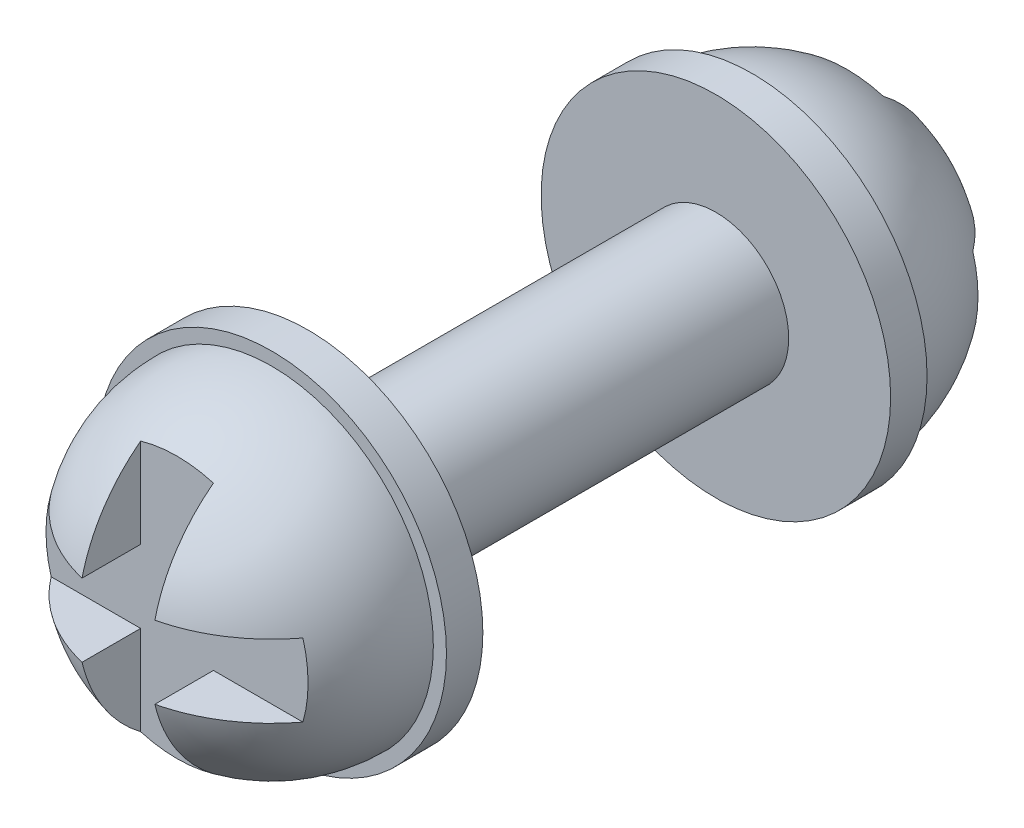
SolidWorks part; units mm, degrees
ref_plane "Front Plane" through (0, 0, 0) normal (0, 0, 1) x (1, 0, 0)
ref_plane "Top Plane" through (0, 0, 0) normal (0, 1, 0) x (1, 0, 0)
ref_plane "Right Plane" through (0, 0, 0) normal (1, 0, 0) x (0, 0, -1)
sketch "Sketch1" plane through (0, 0, 0) normal (1, 0, 0) x (0, 0, -1)
  line L0 (-8.89, 3.175) -> (-8.89, 7.62)
  line L1 (-8.89, 3.175) -> (8.89, 3.175)
  line L2 (-77.1786, 0) -> (81.0028, 0) construction
  line L3 (10.4775, 7.62) -> (8.89, 7.62)
  line L4 (-17.526, 0) -> (-17.526, -14.4217) construction
  line L5 (0, 0) -> (0, 20.5642) construction
  line L7 (8.89, 3.175) -> (8.89, 7.62)
  line L8 (-17.526, 0) -> (17.526, 0)
  line L9 (-10.4775, 7.0485) -> (-10.4775, 7.62)
  line L10 (-10.4775, 7.62) -> (-8.89, 7.62)
  line L11 (10.4775, 7.0485) -> (10.4775, 7.62)
  arc A0 (10.4775, 7.0485) -> (17.526, 0) centre (10.4775, 0) cw
  arc A2 (-10.4775, 7.0485) -> (-17.526, 0) centre (-10.4775, 0) ccw
  dimension "D2" = 17.78
  dimension "D4" = 35.052
  dimension "D1" = 6.35
  dimension "D3" = 15.24
  dimension "D5" = 1.5875
revolve "Revolve1" add sketch "Sketch1" angle 360 about L2
sketch "Sketch2" plane through (0, 0, 0) normal (1, 0, 0) x (0, 0, -1)
  line L0 (0, 0) -> (0, 18.0836) construction
  line L1 (-20.955, 1.5875) -> (-14.605, 1.5875)
  line L2 (-20.955, 1.5875) -> (-20.955, -1.5875)
  line L3 (-20.955, -1.5875) -> (-14.605, -1.5875)
  line L4 (-14.605, 1.5875) -> (-14.605, -1.5875)
  line L5 (0, 0) -> (-14.605, 0) construction
  line L7 (14.605, 1.5875) -> (14.605, -1.5875)
  line L8 (20.955, -1.5875) -> (14.605, -1.5875)
  line L9 (20.955, 1.5875) -> (20.955, -1.5875)
  line L10 (20.955, 1.5875) -> (14.605, 1.5875)
  line L11 (-8.89, -7.62) -> (-8.89, 7.62) construction
  dimension "D1" = 3.175
  dimension "D2" = 6.35
  dimension "D3" = 5.715
extrude "Cut-Extrude1" cut sketch "Sketch2" against normal through all both and the other way through all
sketch "Sketch3" plane through (0.0527, 0, -0.0149) normal (0, 1, 0) x (0, 0, -1)
  line L0 (-0.0149, 0.0527) -> (-0.0149, 18.6125) construction
  line L1 (-22.2399, 1.6402) -> (-14.6199, 1.6402)
  line L2 (-22.2399, 1.6402) -> (-22.2399, -1.5348)
  line L3 (-22.2399, -1.5348) -> (-14.6199, -1.5348)
  line L4 (-14.6199, 1.6402) -> (-14.6199, -1.5348)
  line L5 (-0.0149, 0.0527) -> (-14.6199, 0.0527) construction
  line L7 (14.5901, 1.6402) -> (14.5901, -1.5348)
  line L8 (22.2101, -1.5348) -> (14.5901, -1.5348)
  line L9 (22.2101, 1.6402) -> (22.2101, -1.5348)
  line L10 (22.2101, 1.6402) -> (14.5901, 1.6402)
  line L11 (-14.6199, 5.5413) -> (-14.6199, -5.4359) construction
  dimension "D1" = 3.175
  dimension "D2" = 7.62
extrude "Cut-Extrude2" cut sketch "Sketch3" against normal through all both and the other way through all
